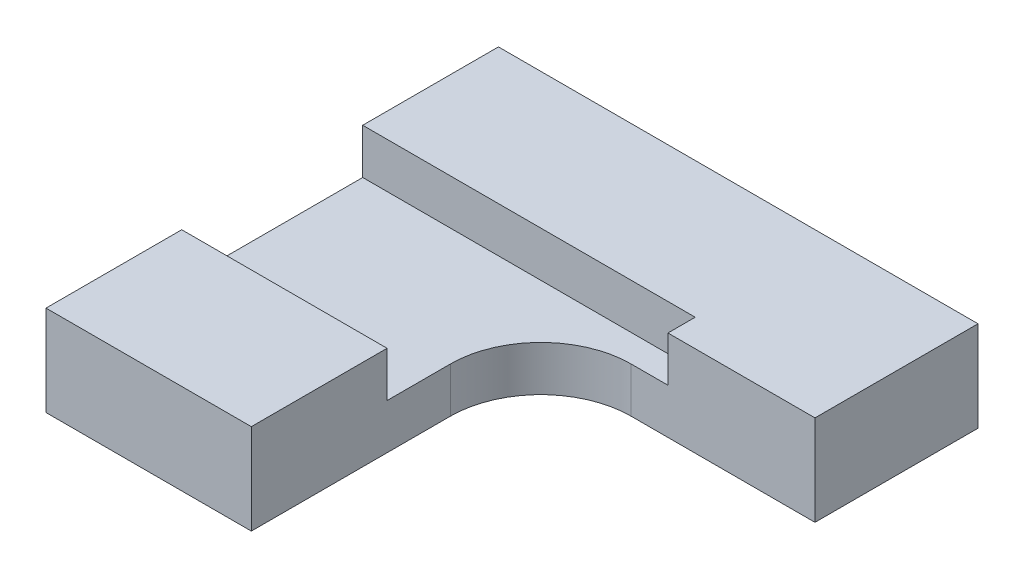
SolidWorks part; units mm, degrees
ref_plane "Front Plane" through (0, 0, 0) normal (0, 0, 1) x (1, 0, 0)
ref_plane "Top Plane" through (0, 0, 0) normal (0, 1, 0) x (1, 0, 0)
ref_plane "Right Plane" through (0, 0, 0) normal (1, 0, 0) x (0, 0, -1)
sketch "Sketch4" plane through (0, 0, 0) normal (0, 1, 0) x (1, 0, 0)
  line L1 (-92.55, 52.88) -> (92.55, 52.88)
  line L2 (-93.55, 51.88) -> (-93.55, -51.88)
  line L3 (-92.55, -52.88) -> (92.55, -52.88)
  line L4 (93.55, 51.88) -> (93.55, -51.88)
  line L5 (-93.55, 52.88) -> (93.55, -52.88) construction
  line L6 (-93.55, -52.88) -> (93.55, 52.88) construction
  arc A0 (-93.55, -51.88) -> (-92.55, -52.88) centre (-92.55, -51.88) ccw
  arc A1 (-92.55, 52.88) -> (-93.55, 51.88) centre (-92.55, 51.88) ccw
  arc A2 (92.55, 52.88) -> (93.55, 51.88) centre (92.55, 51.88) cw
  arc A3 (92.55, -52.88) -> (93.55, -51.88) centre (92.55, -51.88) ccw
  point P0 (0, 0)
  dimension "D3" = 1
  dimension "D4" = 1
  dimension "D1" = 105.76
  dimension "D2" = 187.1
sketch "Sketch8" plane through (0, 0, 0) normal (0, 1, 0) x (1, 0, 0)
  line L1 (-93.55, -10) -> (-91.05, -10)
  line L2 (-93.55, -10) -> (-93.55, 10)
  line L3 (-93.55, 10) -> (-91.05, 10)
  line L5 (-91.05, -10) -> (-91.05, 10)
  line L6 (-93.55, -10) -> (-91.05, 10) construction
  line L7 (-93.55, 10) -> (-91.05, -10) construction
  point P8 (-92.3, 0)
sketch "Sketch9" plane through (0, 0, 0) normal (0, 1, 0) x (1, 0, 0)
  line L1 (-88.5602, 49.016) -> (88.5602, 49.016)
  line L2 (-91.0602, 46.516) -> (-91.0602, -46.516)
  line L3 (-88.5602, -49.016) -> (88.5602, -49.016)
  line L4 (91.0602, 46.516) -> (91.0602, -46.516)
  line L5 (-91.0602, 49.016) -> (91.0602, -49.016) construction
  line L6 (-91.0602, -49.016) -> (91.0602, 49.016) construction
  arc A0 (-88.5602, 49.016) -> (-91.0602, 46.516) centre (-88.5602, 46.516) ccw
  arc A1 (-91.0602, -46.516) -> (-88.5602, -49.016) centre (-88.5602, -46.516) ccw
  arc A2 (88.5602, -49.016) -> (91.0602, -46.516) centre (88.5602, -46.516) ccw
  arc A3 (88.5602, 49.016) -> (91.0602, 46.516) centre (88.5602, 46.516) cw
  point P0 (0, 0)
  dimension "D1" = 2.5
extrude "Boss-Extrude3" add sketch "Sketch9" along normal blind 20
ref_plane "Plane10" through (0, 20, 0) normal (0, 1, 0) x (1, 0, 0)
sketch "Sketch13" plane through (0, 20, 0) normal (0, 1, 0) x (1, 0, 0)
  line L1 (6.0602, 6.984) -> (91.0602, 6.984)
  line L2 (-4.0556, -3.1318) -> (-4.0556, -49.016)
  line L3 (-4.0556, -49.016) -> (91.0602, -49.016)
  line L4 (91.0602, 6.984) -> (91.0602, -49.016)
  arc A0 (6.0602, 6.984) -> (-4.0556, -3.1318) centre (6.0602, -3.1318) ccw
  point P0 (41.9421, -21)
extrude "Cut-Extrude3" cut sketch "Sketch13" against normal blind 8.5 contours L2 L3 L4 L1 A0
sketch "Sketch15" plane through (0, 20, 0) normal (0, 1, 0) x (1, 0, 0)
  line L0 (6.0602, 6.984) -> (91.0602, 6.984) construction
  line L1 (-26.7491, 25) -> (26.2509, 25)
  line L2 (-26.7491, 25) -> (-26.7491, -25)
  line L3 (-26.7491, -25) -> (26.2509, -25)
  line L4 (26.2509, 25) -> (26.2509, -25)
  line L5 (-26.7491, 25) -> (26.2509, -25) construction
  line L6 (-26.7491, -25) -> (26.2509, 25) construction
  line L7 (-4.0556, -3.1318) -> (-4.0556, -49.016) construction
  point P0 (0, 0)
  point P7 (-0.2491, 0)
  dimension "D1" = 18.016
  dimension "D2" = 22.6935
sketch "Sketch16" plane through (0, 20, 0) normal (0, 1, 0) x (1, 0, 0)
  line L1 (-25.2491, 3.5) -> (-21.2491, 3.5)
  line L2 (-25.2491, 3.5) -> (-25.2491, -3.5)
  line L3 (-25.2491, -3.5) -> (-21.2491, -3.5)
  line L4 (-21.2491, 3.5) -> (-21.2491, -3.5)
  line L5 (-25.2491, 3.5) -> (-21.2491, -3.5) construction
  line L6 (-25.2491, -3.5) -> (-21.2491, 3.5) construction
  line L7 (-26.7491, 25) -> (26.2509, 25) construction
  line L8 (-3.5, 21) -> (3.5, 21)
  line L9 (-3.5, 21) -> (-3.5, 25)
  line L10 (-3.5, 25) -> (3.5, 25)
  line L11 (3.5, 21) -> (3.5, 25)
  point P0 (-23.2491, 0)
  point P14 (0, 25)
  point P27 (-23.2491, 0)
  dimension "D1" = 7
  dimension "D2" = 21.5
sketch "Sketch17" plane through (0, 20, 0) normal (0, 1, 0) x (1, 0, 0)
  line L1 (-77.5, 39) -> (-44.5, 39)
  line L2 (-79.5, 37) -> (-79.5, -16.7708)
  line L3 (-77.5, -18.7708) -> (-44.5, -18.7708)
  line L4 (-42.5, 37) -> (-42.5, -16.7708)
  arc A0 (-79.5, -16.7708) -> (-77.5, -18.7708) centre (-77.5, -16.7708) ccw
  arc A1 (-44.5, -18.7708) -> (-42.5, -16.7708) centre (-44.5, -16.7708) ccw
  arc A2 (-44.5, 39) -> (-42.5, 37) centre (-44.5, 37) cw
  arc A3 (-79.5, 37) -> (-77.5, 39) centre (-77.5, 37) cw
  point P0 (-60.4582, 13.6077)
  dimension "D1" = 2
extrude "Cut-Extrude5" cut sketch "Sketch17" against normal blind 10 contours L2 A0 L3 A1 L4 A2 L1 A3
sketch "Sketch24" plane through (0, 0, -39) normal (0, 0, 1) x (1, 0, 0)
  line L0 (-60.5793, 18.6439) -> (-60.5793, 17.2928) construction
  line L3 (-62.9842, 10.9699) -> (-58.1744, 10.9699)
  spline S0 degree 3 poles (-60.5793, 18.6439) (-60.7064, 14.4713) (-61.3034, 11.794) (-62.9842, 10.9699) knots 0 0 0 0 1 1 1 1
  spline S1 degree 3 poles (-60.5793, 18.6439) (-60.4522, 14.4713) (-59.8552, 11.794) (-58.1744, 10.9699) knots 0 0 0 0 1 1 1 1
extrude "Boss-Extrude10" add sketch "Sketch24" along normal blind 50 contours S0 L3 S1
sketch "Sketch27" plane through (0, 20, 0) normal (0, 1, 0) x (1, 0, 0)
  line L0 (-4.0556, -3.1318) -> (-4.0556, -49.016) construction
  line L1 (-79.6944, -26.25) -> (-4.0556, -26.25)
  line L2 (-79.6944, -26.25) -> (-79.6944, -49.0957)
  line L3 (-79.6944, -49.0957) -> (-4.0556, -49.0957)
  line L4 (-4.0556, -26.25) -> (-4.0556, -49.0957)
  line L5 (-79.6944, -26.25) -> (-4.0556, -49.0957) construction
  line L6 (-79.6944, -49.0957) -> (-4.0556, -26.25) construction
  line L7 (-4.0556, -3.1318) -> (-4.0556, -49.016) construction
  point P0 (-41.875, -37.6728)
extrude "Cut-Extrude7" cut sketch "Sketch27" against normal blind 8.5 contours L2 L3 L4 L1
sketch "Sketch29" plane through (0, 20, 0) normal (0, 1, 0) x (1, 0, 0)
  line L1 (-73.1104, -17.3283) -> (-48.6854, -17.3283)
  line L2 (-73.1104, -17.3283) -> (-73.1104, -28.1121)
  line L3 (-73.1104, -28.1121) -> (-48.6854, -28.1121)
  line L4 (-48.6854, -17.3283) -> (-48.6854, -28.1121)
  line L5 (-73.1104, -17.3283) -> (-48.6854, -28.1121) construction
  line L6 (-73.1104, -28.1121) -> (-48.6854, -17.3283) construction
  point P0 (-60.8979, -22.7202)
extrude "Cut-Extrude8" cut sketch "Sketch29" against normal blind 5
extrude "Cut-Extrude12" cut sketch "Sketch16" against normal blind 8 contours L10 L11 L8 L9 | L3 L4 L1 L2
extrude "Cut-Extrude13" cut sketch "Sketch15" against normal blind 1.5
extrude "Boss-Extrude11" add sketch "Sketch4" along normal blind 10 contours L2 A0 L3 A3 L4 A2 L1 A1
extrude "Cut-Extrude14" cut sketch "Sketch8" along normal blind 10 contours L2 L3 L5 L1
mirror "Mirror2" about plane through (0, 0, 0) normal (1, 0, 0) of "Cut-Extrude14"
sketch "Sketch33" plane through (0, 20, 0) normal (0, 1, 0) x (1, 0, 0)
  line L0 (93.55, 10) -> (91.0602, 10) construction
  line L1 (28.4421, 18) -> (98.7229, 18)
  line L2 (28.4421, 18) -> (28.4421, 15)
  line L3 (28.4421, 15) -> (98.7229, 15)
  line L4 (98.7229, 18) -> (98.7229, 15)
  point P15 (92.3051, 10)
  dimension "D1" = 5
extrude "Cut-Extrude47" cut sketch "Sketch33" against normal blind 11.5 contours L3 L4 L1 L2
fillet "Fillet3" radius 1.5 1 edges at (60.9961, 8.5, -18)
fillet "Fillet4" radius 1.5 1 edges at (60.9961, 8.5, -15)
sketch "Sketch34" plane through (0, 0, 0) normal (0, 1, 0) x (1, 0, 0)
  line L0 (-26.7491, 25) -> (26.2509, 25)
  line L1 (26.2509, 25) -> (26.2509, 6.984)
  line L2 (26.2509, 6.984) -> (6.0602, 6.984)
  line L3 (6.0602, 6.984) -> (5.9444, 6.984)
  line L4 (-4.0556, -3.1318) -> (-4.0556, -25)
  line L5 (-4.0556, -25) -> (-26.7491, -25)
  line L6 (-26.7491, -25) -> (-26.7491, 25)
  line L7 (-3.5, 21) -> (3.5, 21)
  line L8 (3.5, 21) -> (3.5, 25)
  line L9 (3.5, 25) -> (-3.5, 25)
  line L10 (-3.5, 25) -> (-3.5, 21)
  line L11 (-25.2491, 3.5) -> (-21.2491, 3.5)
  line L12 (-21.2491, 3.5) -> (-21.2491, -3.5)
  line L13 (-21.2491, -3.5) -> (-25.2491, -3.5)
  line L14 (-25.2491, -3.5) -> (-25.2491, 3.5)
  line L15 (-4.0556, -3.016) -> (-4.0556, -3.1318)
  arc A0 (6.0602, 6.984) -> (-4.0556, -3.1318) centre (6.0602, -3.1318) ccw construction
  arc A1 (6.0602, 6.984) -> (-4.0556, -3.1318) centre (6.0602, -3.1318) ccw construction
  arc A2 (5.9444, 6.984) -> (-4.0556, -3.016) centre (5.9444, -3.016) ccw
  dimension "D1" = 10
extrude "Boss-Extrude14" add sketch "Sketch34" against normal blind 10 contours L6 L0 L1 L2 L3 A2 L15 L4 L5
sketch "Sketch36" plane through (0, 20, 0) normal (0, 1, 0) x (1, 0, 0)
  line L1 (-3.5, 25) -> (3.5, 25)
  line L2 (-3.5, 25) -> (-3.5, 21)
  line L3 (-3.5, 21) -> (3.5, 21)
  line L4 (3.5, 25) -> (3.5, 21)
extrude "Boss-Extrude15" add sketch "Sketch36" against normal blind 36
sketch "Sketch37" plane through (0, 0, 0) normal (0, 1, 0) x (1, 0, 0)
  line L1 (-25.2491, 3.5) -> (-21.2491, 3.5)
  line L2 (-25.2491, 3.5) -> (-25.2491, -3.5)
  line L3 (-25.2491, -3.5) -> (-21.2491, -3.5)
  line L4 (-21.2491, 3.5) -> (-21.2491, -3.5)
extrude "Boss-Extrude16" add sketch "Sketch37" against normal blind 16
sketch "Sketch38" plane through (0, 20, 0) normal (0, 1, 0) x (1, 0, 0)
  line L1 (-116.8483, 70.8666) -> (137.0568, 70.8666)
  line L2 (-116.8483, 70.8666) -> (-116.8483, -69.3717)
  line L3 (-116.8483, -69.3717) -> (137.0568, -69.3717)
  line L4 (137.0568, 70.8666) -> (137.0568, -69.3717)
extrude "Cut-Extrude48" cut sketch "Sketch38" against normal blind 20
sketch "Sketch39" plane through (0, 20, 0) normal (0, 1, 0) x (1, 0, 0)
  line L1 (10, -10) -> (-29.9921, -10)
  line L2 (10, -10) -> (10, 10)
  line L3 (10, 10) -> (-29.9921, 10)
  line L4 (-29.9921, -10) -> (-29.9921, 10)
  line L5 (10, -10) -> (-29.9921, 10) construction
  line L6 (10, 10) -> (-29.9921, -10) construction
  point P0 (0, 0)
  dimension "D1" = 10
extrude "Cut-Extrude49" cut sketch "Sketch39" against normal blind 25
